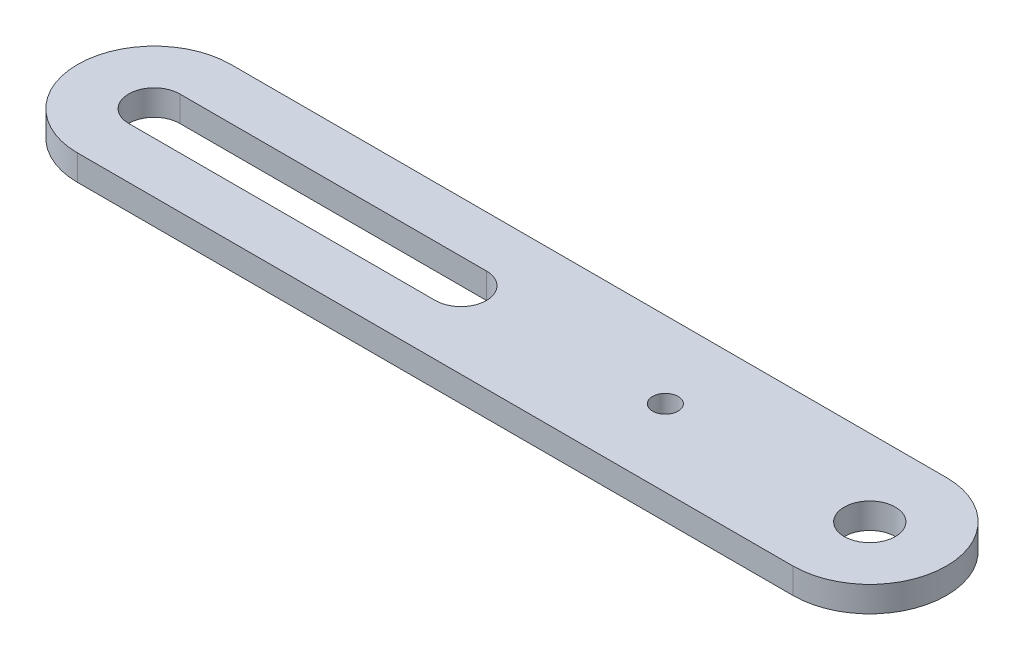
SolidWorks part; units mm, degrees
ref_plane "Front Plane" through (0, 0, 0) normal (0, 0, 1) x (1, 0, 0)
ref_plane "Top Plane" through (0, 0, 0) normal (0, 1, 0) x (1, 0, 0)
ref_plane "Right Plane" through (0, 0, 0) normal (1, 0, 0) x (0, 0, -1)
sketch "Sketch1" plane through (0, 0, 0) normal (0, 1, 0) x (1, 0, 0)
  line L1 (-88.9, -19.05) -> (88.9, -19.05)
  line L3 (-88.9, 19.05) -> (88.9, 19.05)
  line L5 (-88.9, -19.05) -> (88.9, 19.05) construction
  line L6 (-88.9, 19.05) -> (88.9, -19.05) construction
  arc A0 (-88.9, 19.05) -> (-88.9, -19.05) centre (-88.9, 0) ccw
  arc A1 (88.9, 19.05) -> (88.9, -19.05) centre (88.9, 0) cw
  point P0 (0, 0)
  dimension "D1" = 177.8
  dimension "D2" = 38.1
extrude "Boss-Extrude1" add sketch "Sketch1" along normal mid plane 6.35
sketch "Sketch2" plane through (0, 3.175, 0) normal (0, 1, 0) x (1, 0, 0)
  line L0 (0, -19.05) -> (0, 19.05) construction
  line L1 (-88.9, -19.05) -> (88.9, -19.05) construction
  line L2 (-88.9, 19.05) -> (88.9, 19.05) construction
  line L3 (-88.9, 0) -> (-12.7, 0) construction
  line L4 (88.9, 0) -> (38.1, 0) construction
  line L10 (-88.9, 6.35) -> (-12.7, 6.35)
  line L11 (-88.9, -6.35) -> (-12.7, -6.35)
  arc A0 (-88.9, 6.35) -> (-88.9, -6.35) centre (-88.9, 0) ccw
  circle A1 centre (88.9, 0) radius 6.35
  arc A2 (-12.7, -6.35) -> (-12.7, 6.35) centre (-12.7, 0) ccw
  circle A3 centre (38.1, 0) radius 3.175
  point P10 (-50.8, 0)
  dimension "D1" = 12.7
  dimension "D2" = 12.7
  dimension "D4" = 6.35
  dimension "D3" = 76.2
  dimension "D5" = 50.8
extrude "Cut-Extrude1" cut sketch "Sketch2" along direction (0, -1, 0) on the side against the normal through all
